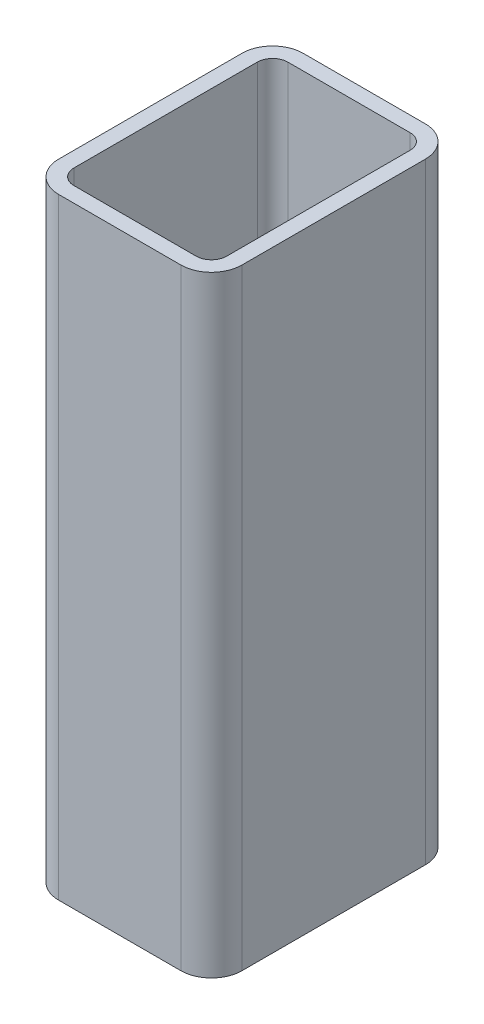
SolidWorks part; units mm, degrees
ref_plane "Front Plane" through (0, 0, 0) normal (0, 0, 1) x (1, 0, 0)
ref_plane "Top Plane" through (0, 0, 0) normal (0, 1, 0) x (1, 0, 0)
ref_plane "Right Plane" through (0, 0, 0) normal (1, 0, 0) x (0, 0, -1)
sketch "Sketch1" plane through (0, 0, 0) normal (0, 0, 1) x (1, 0, 0)
  line L0 (0, 0) -> (0, 254)
  dimension "D1" = 254
other "Structural Member1"
ref_plane "Plane1" through (0, 0, 0) normal (0, 1, 0) x (-1, 0, 0)
sketch "Sketch11" plane through (0, 0, 0) normal (0, 1, 0) x (-1, 0, 0)
  line L0 (-25.4, -44.45) -> (25.4, -44.45)
  line L1 (-31.75, -38.1) -> (-31.75, 38.1)
  line L2 (25.4, 44.45) -> (-25.4, 44.45)
  line L3 (31.75, 38.1) -> (31.75, -38.1)
  line L4 (-25.4, -50.8) -> (25.4, -50.8)
  line L5 (-38.1, -38.1) -> (-38.1, 38.1)
  line L6 (25.4, 50.8) -> (-25.4, 50.8)
  line L7 (38.1, 38.1) -> (38.1, -38.1)
  line L8 (0, 0) -> (38.1, 0) construction
  line L9 (0, 0) -> (0, 50.8) construction
  arc A0 (38.1, 38.1) -> (25.4, 50.8) centre (25.4, 38.1) ccw
  arc A1 (25.4, -50.8) -> (38.1, -38.1) centre (25.4, -38.1) ccw
  arc A2 (-38.1, -38.1) -> (-25.4, -50.8) centre (-25.4, -38.1) ccw
  arc A3 (-25.4, 50.8) -> (-38.1, 38.1) centre (-25.4, 38.1) ccw
  arc A4 (-25.4, 44.45) -> (-31.75, 38.1) centre (-25.4, 38.1) ccw
  arc A5 (31.75, 38.1) -> (25.4, 44.45) centre (25.4, 38.1) ccw
  arc A6 (25.4, -44.45) -> (31.75, -38.1) centre (25.4, -38.1) ccw
  arc A7 (-31.75, -38.1) -> (-25.4, -44.45) centre (-25.4, -38.1) ccw
  point P3 (0, -50.8)
  point P4 (-38.1, 0)
  point P5 (0, 0)
  point P6 (38.1, -50.8)
  point P7 (-38.1, -50.8)
  point P8 (-38.1, 50.8)
  point P33 (0, 0)
  point P35 (38.1, 50.8)
  point P36 (38.1, 0)
  point P37 (0, 50.8)
  dimension "D1" = 12.7
  dimension "Thickness" = 6.35
  dimension "V_leg" = 101.6
  dimension "H_leg" = 76.2
